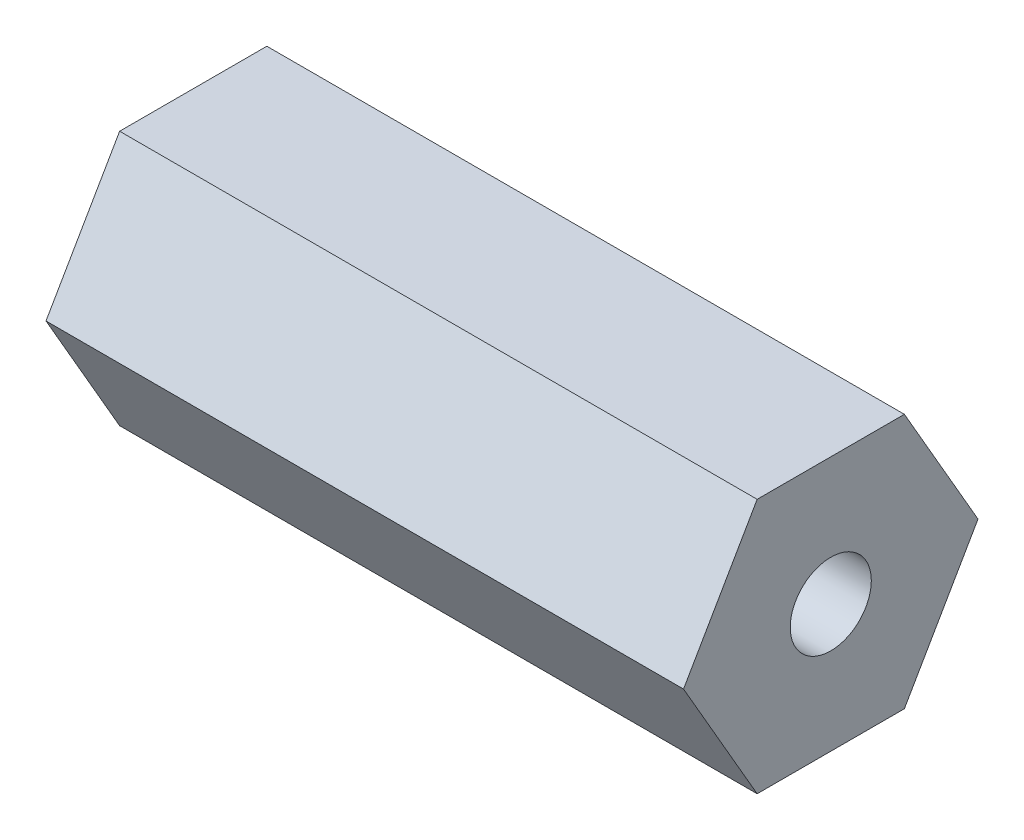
SolidWorks part; units mm, degrees
ref_plane "Front Plane" through (0, 0, 0) normal (0, 0, 1) x (1, 0, 0)
ref_plane "Top Plane" through (0, 0, 0) normal (0, 1, 0) x (1, 0, 0)
ref_plane "Right Plane" through (0, 0, 0) normal (1, 0, 0) x (0, 0, -1)
sketch "Sketch1" plane through (0, 0, 0) normal (1, 0, 0) x (0, 0, -1)
  line L1 (7.3323, 0) -> (3.6662, 6.35)
  line L2 (3.6662, 6.35) -> (-3.6662, 6.35)
  line L3 (-3.6662, 6.35) -> (-7.3323, 0)
  line L4 (-7.3323, 0) -> (-3.6662, -6.35)
  line L5 (-3.6662, -6.35) -> (3.6662, -6.35)
  line L6 (3.6662, -6.35) -> (7.3323, 0)
  circle A0 centre (0, 0) radius 6.35 construction
  dimension "D1" = 12.7
extrude "Boss-Extrude1" add sketch "Sketch1" along normal blind 31.75
hole_wizard "#10-32 Tapped Hole1" positions "3DSketch1" profile "Sketch2" tap size "#10-32" standard "ANSI Inch"
sketch3d "3DSketch1"
  line L0 (31.75, 6.35, 3.6662) -> (31.75, -6.35, -3.6662) construction
  point P0 (31.75, 0, 0)
sketch "Sketch2" plane through (31.75, 0, 0) normal (0, 1, 0) x (0, 0, -1)
  line L0 (0, 0) -> (0, 31.75)
  line L1 (0, 31.75) -> (2.0193, 31.75)
  line L2 (2.0193, 31.75) -> (2.0193, 0)
  line L5 (2.0193, 0) -> (0, 0)
  line L11 (0, -6.35) -> (0, 107.95) construction
  dimension "Thru Tap Drill Dia." = 4.0386
  dimension "Thru Tap Drill Depth" = 31.75
